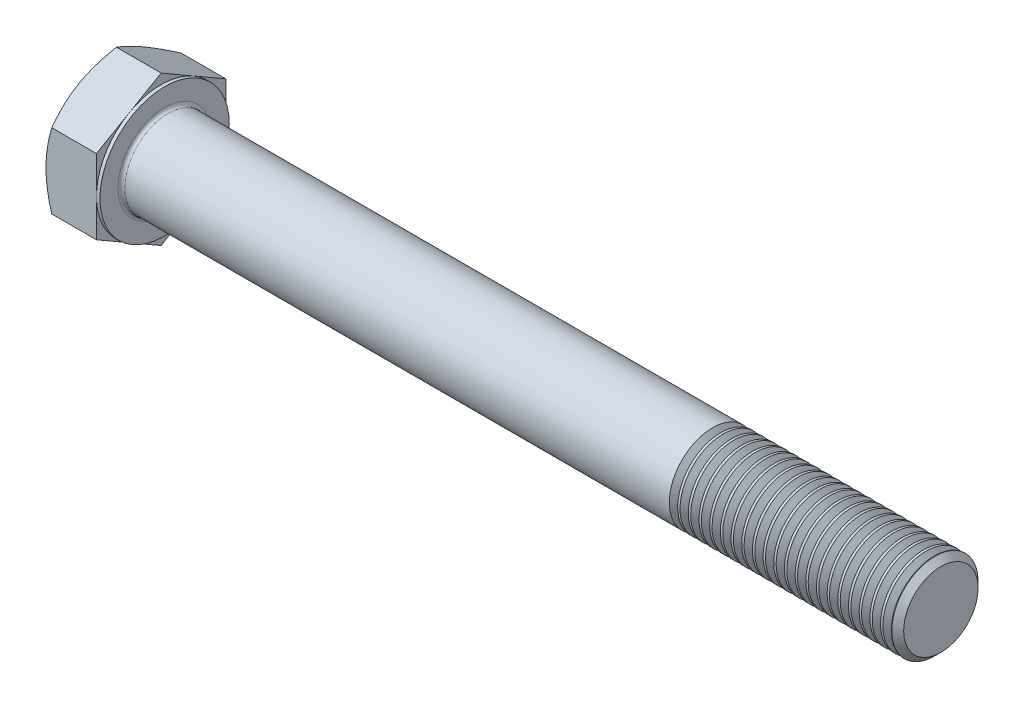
SolidWorks part; units mm, degrees
ref_plane "Plane1" through (0, 0, 0) normal (0, 0, 1) x (1, 0, 0)
ref_plane "Plane2" through (0, 0, 0) normal (0, 1, 0) x (1, 0, 0)
ref_plane "Plane3" through (0, 0, 0) normal (1, 0, 0) x (0, 0, -1)
extrude "BaseHead" add sketch "Sketch1" along normal blind 12.5
sketch "Sketch1" plane through (0, 0, 0) normal (1, 0, 0) x (0, 0, -1)
  line L0 (15, 8.6603) -> (15, -8.6603)
  line L1 (-15, 8.6603) -> (-15, -8.6603)
  line L2 (15, -8.6603) -> (0, -17.3205)
  line L3 (0, -17.3205) -> (-15, -8.6603)
  line L4 (15, 8.6603) -> (0, 17.3205)
  line L5 (0, 17.3205) -> (-15, 8.6603)
  dimension "Width_flats" = 30
  dimension "D2" = 120
  dimension "D3" = 15
  dimension "D4" = 15
  dimension "D5" = 15
revolve "BearingFace" cut sketch "Sketch4"
sketch "Sketch4"
  line L1 (12.5, 17.3205) -> (12.5, 8.6603) construction
  line L2 (12.5, 15) -> (11.7, 15)
  line L3 (12.5, 15) -> (12.5, 27.3205)
  line L4 (12.5, 27.3205) -> (11.7, 27.3205)
  line L5 (0, 0) -> (95.25, 0) construction
  line L6 (0, 0) -> (96.52, 0) construction
  line L7 (11.7, 15) -> (11.7, 27.3205)
  line L8 (12.5, 17.3205) -> (1.3397, 17.3205) construction
revolve "HeadChamfer" cut sketch "Sketch3" angle 360 about L6
sketch "Sketch3" plane through (0, 0, 0) normal (0, 0, 1) x (1, 0, 0)
  line L0 (0, 15) -> (4.2265, 22.3205)
  line L1 (0, 17.3205) -> (0, 8.6603) construction
  line L2 (4.2265, 22.3205) -> (4.2265, 27.3205)
  line L3 (4.2265, 27.3205) -> (-10, 27.3205)
  line L4 (-10, 27.3205) -> (-10, 15)
  line L5 (-10, 15) -> (0, 15)
  line L6 (0, 0) -> (99.06, 0) construction
  line L7 (12.5, 17.3205) -> (0, 17.3205) construction
  dimension "D1" = 15
  dimension "D2" = 5
  dimension "D3" = 10
  dimension "D4" = 5
  dimension "Head_ch_ang" = 30
sketch "BodySke" plane through (0, 0, 0) normal (0, 0, 1) x (1, 0, 0)
  line L0 (0, 8.6603) -> (0, -8.6603) construction
  line L1 (0, 0) -> (192.5, 0)
  line L2 (0, 0) -> (0, 10)
  line L3 (0, 10) -> (191.126, 10)
  line L4 (192.5, 0) -> (192.5, 8.626)
  line L5 (12.5, 17.3205) -> (12.5, 8.6603) construction
  line L6 (192.5, 8.626) -> (191.126, 10)
  line L7 (0, 0) -> (96.52, 0) construction
  line L8 (192.5, -8.626) -> (191.126, -10) construction
  line L9 (0, -10) -> (191.126, -10) construction
  line L10 (15, 15.24) -> (15, -1.27) construction
  line L11 (140.5, 15.24) -> (140.5, -1.27) construction
  line L12 (12.5, 8.6603) -> (12.5, -8.6603) construction
  dimension "Length" = 180
  dimension "Body_ch_ang" = 45
  dimension "Diameter" = 20
  dimension "Minor_dia" = 17.252
  dimension "Advance" = 2.5
  dimension "Thread_nom" = 52
revolve "BaseBody" add sketch "BodySke"
fillet "HeadFillet" radius 0.8 1 edges at (12.5, 0, -10)
sketch "ThdSchSke" plane through (0, 0, 0) normal (0, 0, 1) x (1, 0, 0)
  line L0 (140.5, -8.626) -> (139.5379, -10)
  line L1 (140.5, -8.626) -> (141.4621, -10)
  line L2 (141.4621, -10) -> (141.4621, -12.5)
  line L3 (-3.175, 0) -> (5.1513, 0) construction
  line L5 (141.4621, -12.5) -> (139.5379, -12.5)
  line L6 (139.5379, -12.5) -> (139.5379, -10)
  dimension "Thread_minor" = 17.252
  dimension "Diameter" = 20
  dimension "Start" = 140.5
  dimension "SideAngle" = 55
  dimension "VeeAngle" = 70
  dimension "Overcut" = 25
revolve "ThreadSchematic" cut sketch "ThdSchSke" angle 360 about L3
pattern_linear "ThdSchPat" count 21 spacing 2.4762 along (1, 0, 0) of "ThreadSchematic"
equation "\"D3@Sketch1\" = \"Width_flats@Sketch1\" / 2"
equation "\"D4@Sketch1\" = \"D3@Sketch1\""
equation "\"D5@Sketch1\" = \"D4@Sketch1\""
equation "\"Thread_minor@ThreadCosmetic\" = \"Minor_dia@BodySke\""
equation "\"D1@Sketch3\" = \"Width_flats@Sketch1\" / 2"
equation "\"D1@Sketch4\" = \"Width_flats@Sketch1\""
equation "\"Thread_length@ThreadCosmetic\" = ((sgn( (\"Length@BodySke\" - \"Advance@BodySke\" ) - \"Thread_nom@BodySke\" )-1)*( (\"Length@BodySke\" - \"Advance@BodySke\" ) - \"Thread_nom@BodySke\" ))/-2+ \"Thread_nom@BodySke\""
equation "\"Thread_minor@ThdSchSke\" = \"Minor_dia@BodySke\""
equation "\"Diameter@ThdSchSke\" = \"Diameter@BodySke\""
equation "\"Overcut@ThdSchSke\" = \"Diameter@BodySke\" * 1.25"
equation "\"Start@ThdSchSke\" = \"Head_ht@BaseHead\" + \"Length@BodySke\" - \"Thread_length@ThreadCosmetic\"  '---Non-countersunk---"
equation "\"Num_threads@ThdSchPat\" = int( \"Thread_length@ThreadCosmetic\" / \"Advance@BodySke\" + 0.999 )  + 1"
equation "\"Advance@ThdSchPat\" = \"Thread_length@ThreadCosmetic\" /  (\"Num_threads@ThdSchPat\" - 1) 'relax it"
equation "\"Num_threads@ThdSchPat\" = \"Num_threads@ThdSchPat\" - sgn( \"Num_threads@ThdSchPat\" - 1) '---chamfered tips only---"
